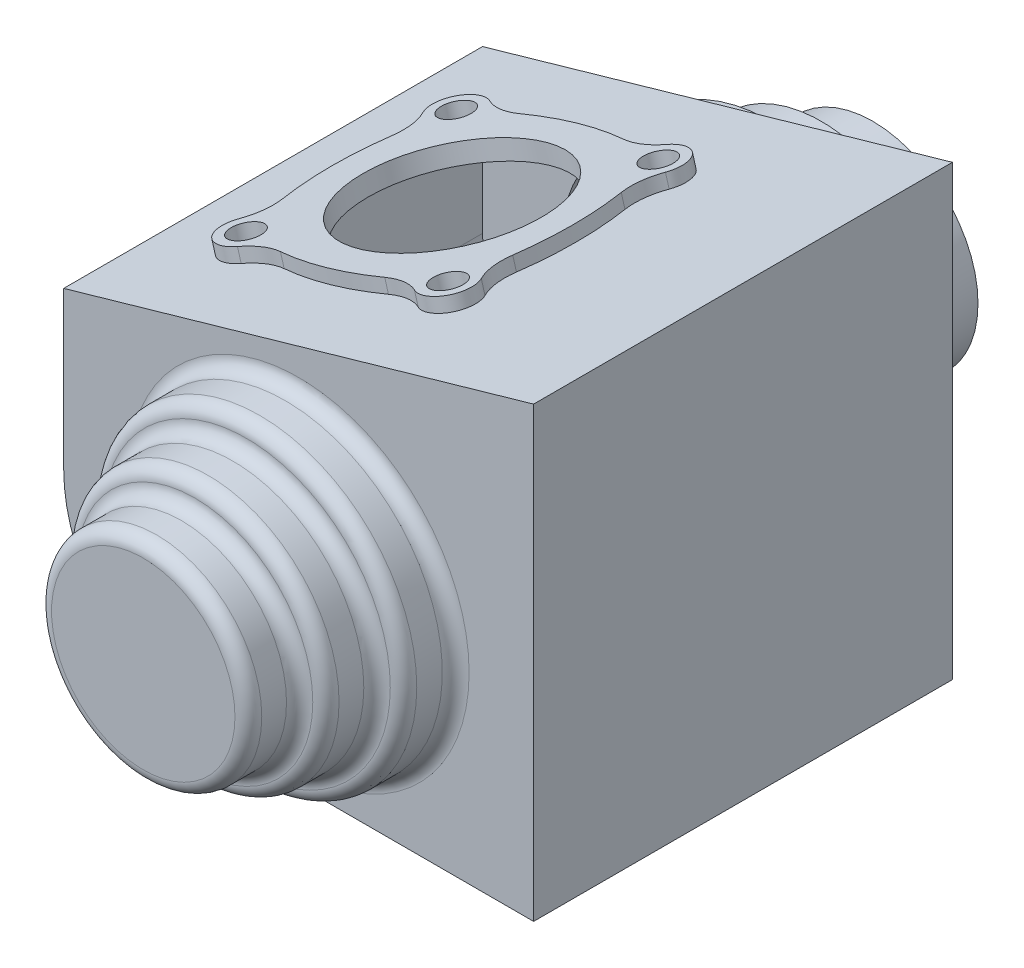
SolidWorks part; units mm, degrees
ref_plane "Front Plane" through (0, 0, 0) normal (0, 0, 1) x (1, 0, 0)
ref_plane "Top Plane" through (0, 0, 0) normal (0, 1, 0) x (1, 0, 0)
ref_plane "Right Plane" through (0, 0, 0) normal (1, 0, 0) x (0, 0, -1)
sketch "Sketch1" plane through (0, 0, 0) normal (0, 0, 1) x (1, 0, 0)
  line L0 (-38, -89) -> (114, -89)
  line L1 (114, -89) -> (114, 128.3779)
  line L2 (114, 128.3779) -> (-114, 63)
  line L3 (-114, 63) -> (-114, -13)
  line L4 (0, 0) -> (0, 119.6174) construction
  line L5 (152.7319, 0) -> (0, 0) construction
  arc A0 (-38, -89) -> (-114, -13) centre (-38, -13) cw
  point P9 (-114, -89)
  dimension "D5" = 76
  dimension "D1" = 228
  dimension "D2" = 152
  dimension "D3" = 106
  dimension "D4" = 89
extrude "Boss-Extrude1" add sketch "Sketch1" along normal mid plane 203.2
sketch "Sketch2" plane through (0, 0, 101.6) normal (0, 0, 1) x (1, 0, 0)
  line L0 (-38, -89) -> (114, -89) construction
  circle A0 centre (0, -0.1) radius 76.2
  dimension "D1" = 152.4
  dimension "D2" = 88.9
extrude "Boss-Extrude2" add sketch "Sketch2" along normal blind 25.4
sketch "Sketch3" plane through (0, 0, 127) normal (0, 0, 1) x (1, 0, 0)
  circle A0 centre (0, -0.1) radius 63.5
  dimension "D1" = 127
extrude "Boss-Extrude3" add sketch "Sketch3" along normal blind 25
sketch "Sketch4" plane through (0, 0, 152) normal (0, 0, 1) x (1, 0, 0)
  circle A0 centre (0, -0.1) radius 51
  dimension "D1" = 102
extrude "Boss-Extrude4" add sketch "Sketch4" along normal blind 25
mirror "Mirror1" about plane through (0, 0, 0) normal (0, 0, 1) of "Boss-Extrude2", "Boss-Extrude3", "Boss-Extrude4"
shell "Shell1" thickness 2.5
sketch "Sketch6" plane through (-25.3537, 88.4189, 0) normal (-0.2756, 0.9613, 0) x (0.9613, 0.2756, 0)
  line L0 (47.1804, 0) -> (0, 0) construction
  line L1 (0, 0) -> (0, 45.8535) construction
  arc A0 (-44.6757, 61.1982) -> (-61.1982, 44.6757) centre (-51, 51) ccw
  arc A1 (61.1982, 44.6757) -> (44.6757, 61.1982) centre (51, 51) ccw
  arc A2 (-61.1982, -44.6757) -> (-44.6757, -61.1982) centre (-51, -51) ccw
  arc A3 (44.6757, -61.1982) -> (61.1982, -44.6757) centre (51, -51) ccw
  arc A4 (57.9871, 26.3191) -> (57.9871, -26.3191) centre (-66.2558, 0) cw
  arc A5 (-26.3191, 57.9871) -> (26.3191, 57.9871) centre (0, -66.2558) cw
  arc A6 (-26.3191, -57.9871) -> (26.3191, -57.9871) centre (0, 66.2558) ccw
  arc A7 (-57.9871, -26.3191) -> (-57.9871, 26.3191) centre (66.2558, 0) cw
  arc A8 (-26.3191, 57.9871) -> (-44.6757, 61.1982) centre (-31.5, 82.4444) cw
  arc A9 (26.3191, 57.9871) -> (44.6757, 61.1982) centre (31.5, 82.4444) ccw
  arc A10 (57.9871, 26.3191) -> (61.1982, 44.6757) centre (82.4444, 31.5) cw
  arc A11 (57.9871, -26.3191) -> (61.1982, -44.6757) centre (82.4444, -31.5) ccw
  arc A12 (26.3191, -57.9871) -> (44.6757, -61.1982) centre (31.5, -82.4444) cw
  arc A13 (-57.9871, -26.3191) -> (-61.1982, -44.6757) centre (-82.4444, -31.5) cw
  arc A14 (-57.9871, 26.3191) -> (-61.1982, 44.6757) centre (-82.4444, 31.5) ccw
  arc A15 (-26.3191, -57.9871) -> (-44.6757, -61.1982) centre (-31.5, -82.4444) ccw
  dimension "D1" = 24
  dimension "D4" = 25
  dimension "D5" = 127
  dimension "D6" = 63
  dimension "D2" = 102
  dimension "D3" = 102
  dimension "D7" = 63
extrude "Boss-Extrude5" add sketch "Sketch6" along normal blind 6.5
sketch "Sketch7" plane through (-27.1454, 94.6671, 0) normal (-0.2756, 0.9613, 0) x (0.9613, 0.2756, 0)
  circle A0 centre (-51, 51) radius 7.5
  circle A1 centre (51, 51) radius 7.5
  circle A2 centre (51, -51) radius 7.5
  circle A3 centre (-51, -51) radius 7.5
  circle A4 centre (0, 0) radius 45
  dimension "D1" = 15
  dimension "D2" = 90
extrude "Cut-Extrude1" cut sketch "Sketch7" against normal up to next
fillet "Fillet2" radius 6.5 3 edges at (76.2, -0.1, 127) (63.5, -0.1, 152) (51, -0.1, 177)
fillet "Fillet3" radius 6.5 3 edges at (-76.2, -0.1, 101.6) (63.5, -0.1, 127) (51, -0.1, 152)
